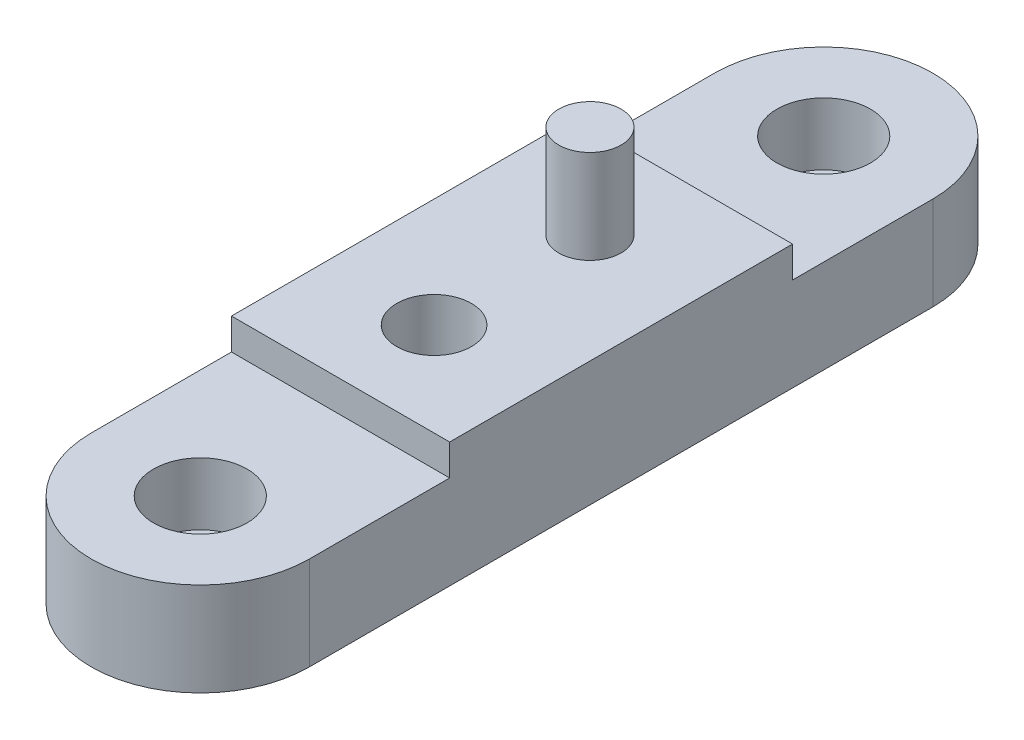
SolidWorks part; units mm, degrees
ref_plane "Front" through (0, 0, 0) normal (0, 0, 1) x (1, 0, 0)
ref_plane "Top" through (0, 0, 0) normal (0, 1, 0) x (1, 0, 0)
ref_plane "Right" through (0, 0, 0) normal (1, 0, 0) x (0, 0, -1)
sketch "Sketch1" plane through (0, 0, 0) normal (0, 1, 0) x (1, 0, 0)
  line L0 (0, 1.5) -> (-8.1896, 1.5) construction
  line L1 (0, 3.5) -> (-8.1896, 3.5) construction
  line L2 (-3.5, -10) -> (3.5, -10)
  line L3 (-3.5, 0) -> (3.5, 0) construction
  line L4 (-3.5, 0) -> (-3.5, -10)
  line L6 (3.5, 0) -> (3.5, -10)
  circle A0 centre (0, 0) radius 1.5 construction
  arc A1 (3.5, 0) -> (-3.5, 0) centre (0, 0) ccw
  dimension "D1" = 3
  dimension "D2" = 2
  dimension "D3" = 10
extrude "Boss-Extrude1" add sketch "Sketch1" along normal blind 4
sketch "Sketch2" plane through (0, 4, 0) normal (0, 1, 0) x (1, 0, 0)
  line L0 (0, 0) -> (-11.0692, 0) construction
  line L1 (-3.5, -4.5) -> (3.5, -4.5)
  line L2 (-3.5, 0) -> (-3.5, -10) construction
  line L3 (3.5, -10) -> (3.5, 0) construction
  line L4 (-3.5, 0) -> (-3.5, -4.5)
  line L5 (3.5, 0) -> (3.5, -4.5)
  line L6 (0, -3.5) -> (-8.4344, -3.5) construction
  arc A0 (3.5, 0) -> (-3.5, 0) centre (0, 0) ccw construction
  arc A1 (3.5, 0) -> (-3.5, 0) centre (0, 0) ccw
  circle A2 centre (0, 0) radius 3.5 construction
  dimension "D1" = 1
extrude "Cut-Extrude1" cut sketch "Sketch2" against normal blind 1
sketch "Sketch3" plane through (0, 3, 0) normal (0, 1, 0) x (1, 0, 0)
  circle A0 centre (0, 0) radius 1.5
  dimension "D1" = 3
extrude "Cut-Extrude2" cut sketch "Sketch3" against normal blind 2
mirror "Mirror1" about plane through (-3.5, 4, 10) normal (0, 0, -1)
sketch "Sketch4" plane through (0, 4, 0) normal (0, 1, 0) x (1, 0, 0)
  line L0 (0, -4.5) -> (0, -15.5) construction
  line L1 (-3.5, -4.5) -> (3.5, -4.5) construction
  line L2 (-3.5, -15.5) -> (3.5, -15.5) construction
  line L3 (0, -10) -> (-6.044, -10) construction
  circle A0 centre (0, -7.5) radius 1
  dimension "D2" = 2
  dimension "D1" = 2.5
extrude "Boss-Extrude2" add sketch "Sketch4" along normal blind 3
sketch "Sketch5" plane through (0, 4, 0) normal (0, 1, 0) x (1, 0, 0)
  line L0 (0, -4.5) -> (0, -15.5) construction
  line L1 (-3.5, -4.5) -> (3.5, -4.5) construction
  line L2 (-3.5, -15.5) -> (3.5, -15.5) construction
  line L3 (0, -10) -> (-7.1463, -10) construction
  circle A0 centre (0, -12.5) radius 1.2
  dimension "D2" = 2.4
  dimension "D1" = 2.5
extrude "Cut-Extrude3" cut sketch "Sketch5" against normal blind 4
